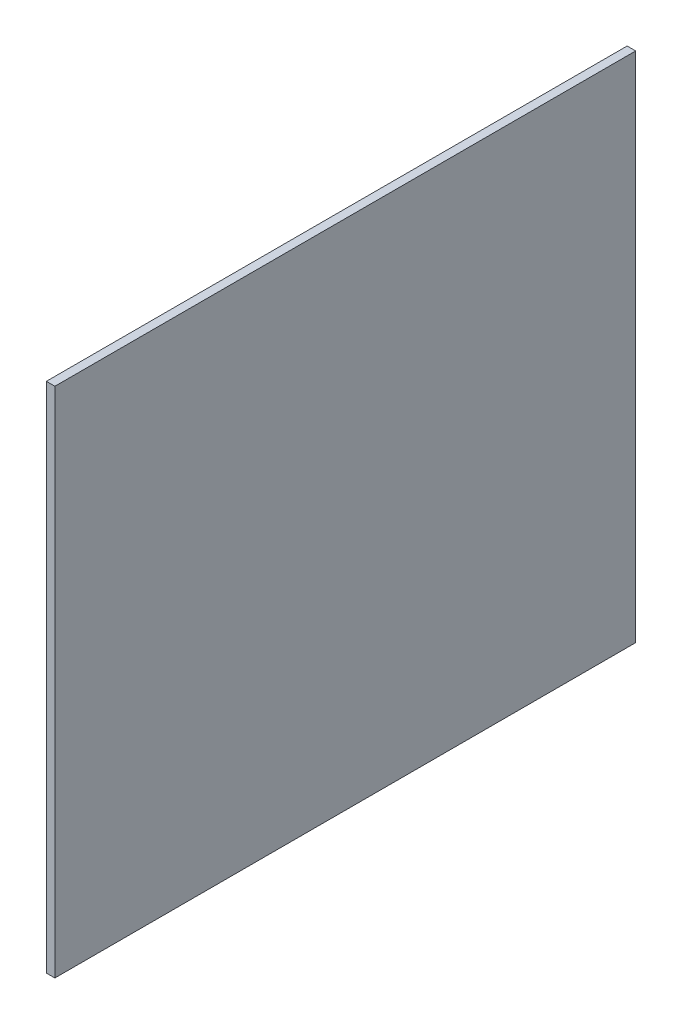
SolidWorks part; units mm, degrees
ref_plane "Front Plane" through (0, 0, 0) normal (0, 0, 1) x (1, 0, 0)
ref_plane "Top Plane" through (0, 0, 0) normal (0, 1, 0) x (1, 0, 0)
ref_plane "Right Plane" through (0, 0, 0) normal (1, 0, 0) x (0, 0, -1)
sketch "Sketch1" plane through (0, 0, 0) normal (0, 0, 1) x (1, 0, 0)
  line L0 (0, -190.5) -> (0, 190.5)
  line L1 (0, 190.5) -> (6.35, 190.5)
  line L2 (6.35, 190.5) -> (6.35, -190.5)
  line L3 (0, 0) -> (39.643, 0) construction
  line L4 (0, -190.5) -> (6.35, -190.5)
  point P7 (6.35, 0)
  dimension "D1" = 6.35
  dimension "D2" = 190.5
extrude "Extrude1" add sketch "Sketch1" along normal mid plane 431.8
